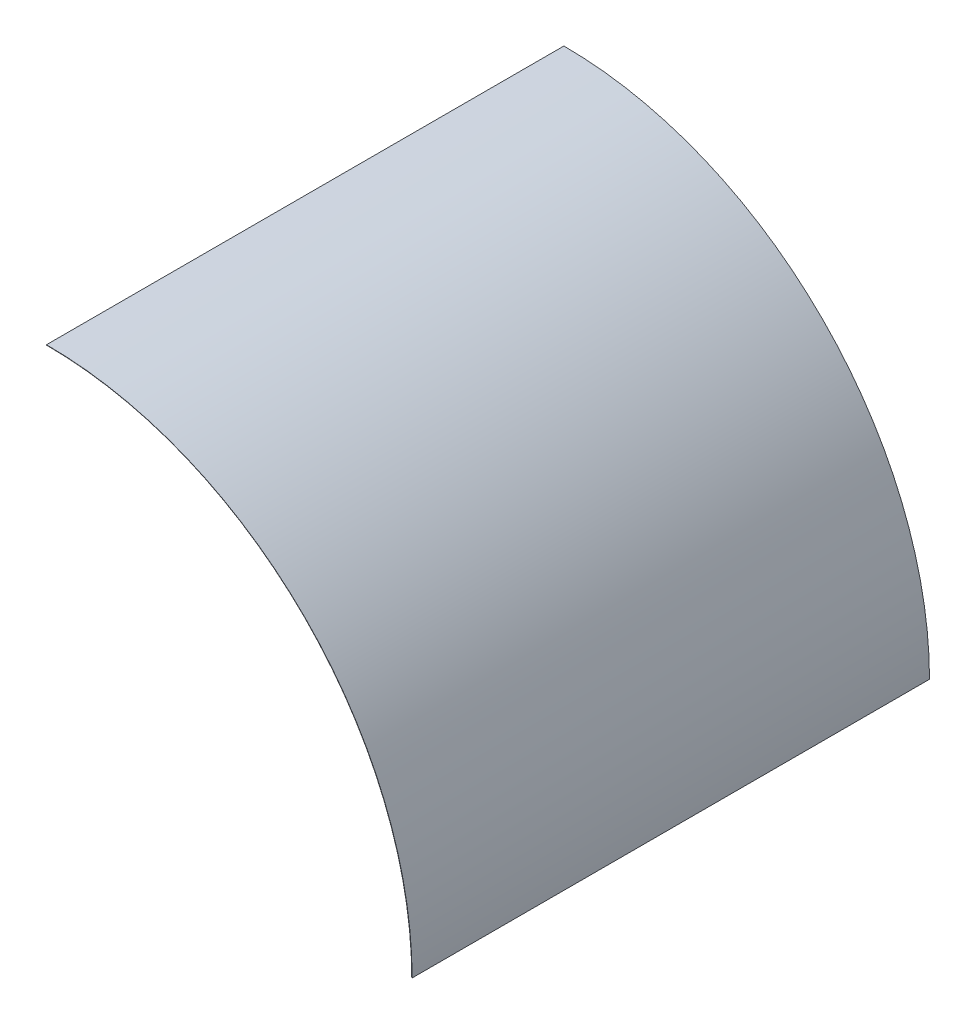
SolidWorks part; units mm, degrees
ref_plane "Front Plane" through (0, 0, 0) normal (0, 0, 1) x (1, 0, 0)
ref_plane "Top Plane" through (0, 0, 0) normal (0, 1, 0) x (1, 0, 0)
ref_plane "Right Plane" through (0, 0, 0) normal (1, 0, 0) x (0, 0, -1)
sketch "Sketch1" plane through (0, 0, 0) normal (0, 0, 1) x (1, 0, 0)
  line L0 (0, 0) -> (0, 45.174) construction
  line L1 (0, 0) -> (40.8023, 0) construction
  line L2 (0, 2120) -> (0, 2118)
  line L3 (2120, 0) -> (2118, 0)
  arc A0 (0, 2118) -> (2118, 0) centre (0, 0) cw
  arc A1 (0, 2120) -> (2120, 0) centre (0, 0) cw
  dimension "D1" = 2118
  dimension "D2" = 2
extrude "Boss-Extrude1" add sketch "Sketch1" against normal blind 3000
